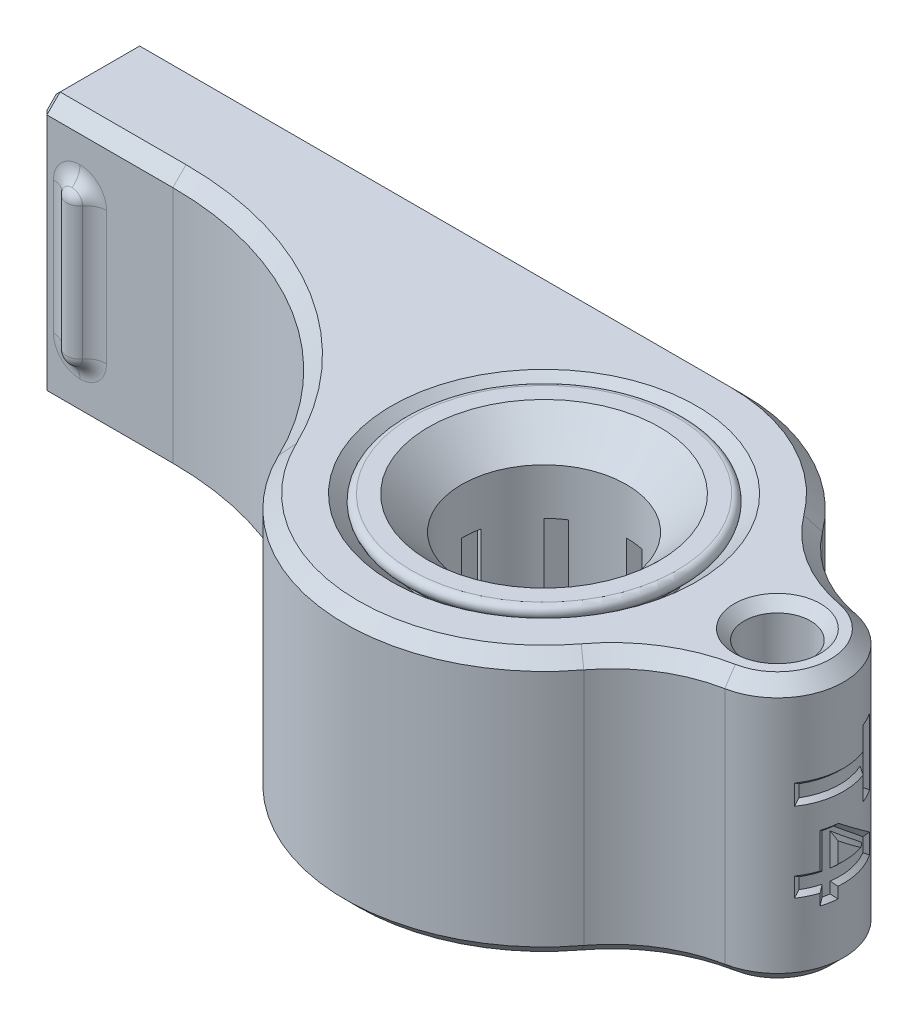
SolidWorks part; units mm, degrees
ref_plane "Ebene vorne" through (0, 0, 0) normal (0, 0, 1) x (1, 0, 0)
ref_plane "Ebene oben" through (0, 0, 0) normal (0, 1, 0) x (1, 0, 0)
ref_plane "Ebene rechts" through (0, 0, 0) normal (1, 0, 0) x (0, 0, -1)
sketch "Skizze2" plane through (0, 0, 0) normal (0, 1, 0) x (1, 0, 0)
  line L0 (0, 15) -> (-45, 15)
  line L1 (-45, 15) -> (-45, 7)
  line L2 (-45, 7) -> (-35, 7)
  arc A0 (-13.5167, -6.5038) -> (0, 15) centre (0, 0) ccw
  arc A1 (-35, 7) -> (-13.5167, -6.5038) centre (-35, -16.8409) cw
  dimension "D1" = 30
  dimension "D2" = 8
  dimension "D3" = 45
  dimension "D4" = 10
extrude "Aufsatz-Linear austragen1" add sketch "Skizze2" along normal blind 20
sketch "Skizze3" plane through (0, 20, 0) normal (0, 1, 0) x (1, 0, 0)
  circle A0 centre (0, 0) radius 8.5
  dimension "D1" = 17
extrude "Schnitt-Linear austragen1" cut sketch "Skizze3" against normal through all
ref_plane "Ebene1" through (0, 1.5, 0) normal (0, -1, 0) x (-1, 0, 0)
sketch "Skizze5" plane through (0, 1.5, 0) normal (0, -1, 0) x (-1, 0, 0)
  line L0 (45, 13.5) -> (0, 13.5)
  line L1 (35, 8.5) -> (45, 8.5)
  line L2 (45, 8.5) -> (45, 13.5)
  line L3 (45, 15) -> (45, 7) construction
  line L4 (0, 15) -> (45, 15) construction
  line L5 (45, 7) -> (35, 7) construction
  arc A0 (0, 13.5) -> (12.165, -5.8534) centre (0, 0) ccw
  arc A1 (12.165, -5.8534) -> (35, 8.5) centre (35, -16.8409) cw
  arc A2 (35, 7) -> (13.5167, -6.5038) centre (35, -16.8409) ccw construction
  circle A5 centre (0, 0) radius 10
  circle A6 centre (0, 0) radius 8.5 construction
  dimension "D3" = 1.5
  dimension "D1" = 1.5
  dimension "D2" = 1.5
extrude "Schnitt-Linear austragen2" cut sketch "Skizze5" against normal offset from surface (17 mm away) 1.5
chamfer "Fase3" distance 2 angle 45 2 edges at (0, 18.5, 10) (0, 1.5, -10)
chamfer "Fase1" distance 3 angle 45 2 edges at (0, 20, 8.5) (0, 0, 8.5)
ref_plane "Ebene2" through (0, 10, 0) normal (0, -1, 0) x (-1, 0, 0)
sketch "Skizze6" plane through (0, 10, 0) normal (0, -1, 0) x (-1, 0, 0)
  line L0 (0, 8.5) -> (2.0977, 11)
  line L1 (2.0977, 11) -> (3.5337, 11)
  line L2 (3.5337, 11) -> (0, 6.7887)
  line L3 (0, 6.7887) -> (0, 8.5)
  line L4 (0, 0) -> (0, 8.5) construction
  circle A0 centre (0, 0) radius 8.5 construction
  dimension "D1" = 40
  dimension "D2" = 1.1
  dimension "D3" = 11
extrude "Schnitt-Linear austragen3" cut sketch "Skizze6" against normal mid plane 8
pattern_circular "Kreismuster1" count 8 over 360 about axis through (0, 0, 0) along (0, 1, 0) of "Schnitt-Linear austragen3"
sketch "Skizze8" plane through (0, 0, 0) normal (1, 0, 0) x (0, 0, -1)
  line L0 (0, 0) -> (0, 25.1561) construction
  line L1 (11.2172, 20) -> (6.2172, 20)
  line L2 (6.2172, 20) -> (6.2172, 0)
  line L3 (6.2172, 0) -> (11.2172, 0)
  line L4 (11.2172, 0) -> (8.2172, 3)
  line L5 (-8.5, 3) -> (8.5, 3) construction
  line L6 (8.2172, 3) -> (8.2172, 17)
  line L7 (-8.5, 17) -> (8.5, 17) construction
  line L8 (8.2172, 17) -> (11.2172, 20)
  line L9 (8.5, 17) -> (11.5, 20) construction
  line L10 (11.5, 0) -> (8.5, 3) construction
  line L11 (8.5, 17) -> (11.5, 20) construction
  line L12 (15, 20) -> (-15, 20) construction
  line L13 (-15, 0) -> (15, 0) construction
  dimension "D1" = 0.2
  dimension "D2" = 2
revolve "Rotor" add sketch "Skizze8" angle 360 about L0
sketch "Skizze9" plane through (0, 10, 0) normal (0, -1, 0) x (-1, 0, 0)
  line L0 (0, 4.5059) -> (0, 6.2172)
  line L1 (0, 6.2172) -> (-1.5538, 8.0689)
  line L2 (0, 4.5059) -> (-2.7242, 7.7524)
  arc A0 (-1.5538, 8.0689) -> (-2.7242, 7.7524) centre (0, 0) ccw
  circle A1 centre (0, 0) radius 6.2172 construction
  circle A2 centre (0, 0) radius 8.2172 construction
  dimension "D1" = 40
  dimension "D2" = 1.1
extrude "Schnitt-Linear austragen4" cut sketch "Skizze9" against normal mid plane 8
pattern_circular "Kreismuster2" count 8 over 360 about axis through (0, 0, 0) along (0, 1, 0) of "Schnitt-Linear austragen4"
sketch "Skizze12" plane through (0, 10, 0) normal (0, 1, 0) x (1, 0, 0)
  line L1 (-45, 7) -> (-35, 7) construction
  line L2 (-45, 15) -> (-45, 7) construction
  line L3 (-43, 7) -> (-41, 7)
  arc A0 (-41, 7) -> (-43, 7) centre (-42, 7) cw
  dimension "D1" = 2
  dimension "D2" = 1
  dimension "D3" = 2
extrude "Aufsatz-Linear austragen3" add sketch "Skizze12" against normal mid plane 12
sketch "Skizze14" plane through (0, 0, 0) normal (0, 0, 1) x (1, 0, 0)
  line L0 (13.5, 14) -> (13.5, 6)
  line L1 (13.5, 1.5) -> (13.5, 18.5) construction
  line L2 (13.5, 6) -> (14.25, 6.8938)
  line L3 (14.25, 6.8938) -> (14.25, 13.1062)
  line L4 (14.25, 13.1062) -> (13.5, 14)
  line L5 (-15.4, 10) -> (15.4, 10) construction
  line L6 (0, 0) -> (0, 26.8942) construction
  point P9 (13.5, 10)
  point P10 (14.25, 10)
  dimension "D1" = 8
  dimension "D2" = 40
  dimension "D3" = 0.75
revolve "Schnitt-Rotation1" cut sketch "Skizze14" angle 360 about L6
fillet "Verrundung1" radius 0.5 2 edges at (0, 0, -11.2172) (0, 20, -11.2172)
chamfer "Fase2" distance 2.5 angle 45 2 edges at (0, 20, -6.2172) (0, 0, -6.2172)
chamfer "Fase4" distance 1 angle 45 8 edges at (-22.5, 18.5, -13.5) (-21.5143, 18.5, -4.6136) (-40, 18.5, -8.5) (-22.5, 1.5, -13.5) (-21.5143, 1.5, -4.6136) (-40, 1.5, -8.5) (11.4296, 18.5, 7.1843) (11.4296, 1.5, 7.1843)
sketch "Skizze11" plane through (0, 0, -8.5) normal (0, 0, -1) x (-1, 0, 0)
  line L0 (45, 17.5) -> (45, 2.5) construction
  line L1 (45, 10.75) -> (35, 10.75)
  line L2 (45, 10.75) -> (45, 9.25)
  line L3 (45, 9.25) -> (35, 9.25)
  line L4 (35, 10.75) -> (35, 9.25)
  line L6 (-15.4, 10) -> (15.4, 10) construction
  point P12 (45, 10)
  dimension "D1" = 1.5
  dimension "D2" = 10
extrude "Aufsatz-Linear austragen2" add sketch "Skizze11" along normal up to next
sketch "Skizze15" plane through (0, 10, 0) normal (0, -1, 0) x (-1, 0, 0)
  line L0 (41, 15) -> (43, 15)
  line L1 (43, 15) -> (42, 14.25)
  line L2 (42, 14.25) -> (41, 15)
  line L3 (42, 14.25) -> (42, 15) construction
  line L4 (45, 15) -> (45, 7) construction
  line L5 (0, 15) -> (45, 15) construction
  dimension "D1" = 2
  dimension "D2" = 0.75
  dimension "D3" = 2
extrude "Schnitt-Linear austragen5" cut sketch "Skizze15" against normal mid plane 10 contours L1 L2 L0
pattern_linear "Lineares Muster1" count 5 spacing 3 along (1, 0, 0) of "Schnitt-Linear austragen5"
sketch "Skizze17" plane through (0, 20, 0) normal (0, 1, 0) x (1, 0, 0)
  line L2 (17.6, 0) -> (0, 0) construction
  arc A0 (-13.5167, -6.5038) -> (0, 15) centre (0, 0) ccw construction
  arc A1 (12, -9) -> (12, 9) centre (0, 0) ccw
  arc A2 (18.5438, 4.9101) -> (18.5438, -4.9101) centre (17.6, 0) cw
  circle A3 centre (17.6, 0) radius 2.5
  arc A4 (12, 9) -> (18.5438, 4.9101) centre (20.5647, 15.4235) ccw
  arc A5 (18.5438, -4.9101) -> (12, -9) centre (20.5647, -15.4235) ccw
  dimension "D1" = 5
  dimension "D2" = 2.5
  dimension "D3" = 0.1
  dimension "D4" = 18
extrude "Aufsatz-Linear austragen5" add sketch "Skizze17" against normal up to surface (20 mm away) contours A2 A5 A1 A4 | A3
ref_plane "Ebene3" through (22.6, 0, 0) normal (1, 0, 0) x (0, 0, -1)
sketch "Skizze16" plane through (22.6, 0, 18.9001) normal (-1, 0, 0) x (0, 0, 1)
  line L0 (-15.9001, 0) -> (-15.9001, 20) construction
  line L1 (-3.9001, 20) -> (-12.3963, 20) construction
  line L2 (-12.3963, 0) -> (-3.9001, 0) construction
  text T0 "T4" font "Tahoma" height 6
  dimension "D1" = 3
wrap "Umwickeln1" sketch "Skizze16" wrap type deboss source sketch "Skizze16" thickness 0.3 parameters "D1"=0.3
fillet "Fase10" radius 0.3 22 edges at (22.074, 5.443, 1.44) (21.8204, 5.8608, 2.0684) (21.4791, 6.5823, 2.6538) (21.8204, 7.3038, 2.0684) (22.1442, 5.8608, -1.2002) (22.2836, 5.443, 0.3922) (22.2695, 13.3797, 0.5343) (21.9783, 14.2532, -1.709) (21.7556, 15.1266, -2.1957) (21.4791, 12.6203, -2.6538) (21.7556, 10.1139, -2.1957) (22.2695, 11.8608, 0.5343) (22.074, 8.6329, 1.44) (22.2087, 5.0253, 0.9221) (21.9783, 10.9873, -1.709) (21.4791, 12.6203, 2.6538)
chamfer "Fase5" distance 1 angle 45 16 edges at (-22.5, 0, -15) (-1.4604, 0, 14.9287) (6.7082, 0, -13.4164) (-22.3125, 0, -3.3437) (-40, 0, -7) (-22.5, 20, -15) (-1.4604, 20, 14.9287) (6.7082, 20, -13.4164) (-22.3125, 20, -3.3437) (-40, 20, -7) (14.8906, 0, -6.345) (14.8906, 20, -6.345) (22.6, 0, 0) (22.6, 20, 0) (14.8906, 0, 6.345) (14.8906, 20, 6.345)
chamfer "Fase9" distance 0.75 angle 45 10 edges at (-42, 5, -15) (-39, 5, -15) (-36, 5, -15) (-33, 5, -15) (-30, 5, -15) (-30, 15, -15) (-33, 15, -15) (-36, 15, -15) (-39, 15, -15) (-42, 15, -15)
chamfer "Fase6" distance 1 angle 45 6 edges at (-40, 10.75, -8.5) (-40, 10.75, -13.5) (-40, 9.25, -13.5) (-40, 9.25, -8.5) (-35, 10, -13.5) (-35, 10, -8.5)
fillet "Verrundung2" radius 1.5 2 edges at (0, 3, 8.5) (0, 16.5, 10)
chamfer "Fase7" distance 0.5 angle 45 24 edges at (-45, 19.5, -7.5) (-45, 10, -7) (-45, 0.5, -7.5) (-45, 0, -11) (-45, 0.5, -14.5) (-45, 10, -15) (-45, 19.5, -14.5) (-45, 20, -11) (-45, 18.5, -11) (-45, 18, -13) (-45, 14.625, -13.5) (-45, 11.25, -13) (-45, 10.75, -11) (-45, 11.25, -9) (-45, 14.625, -8.5) (-45, 18, -9) (-45, 2, -9) (-45, 1.5, -11) (-45, 2, -13) (-45, 5.375, -13.5) (-45, 8.75, -13) (-45, 9.25, -11) (-45, 8.75, -9) (-45, 5.375, -8.5)
fillet "Verrundung5" radius 1 2 edges at (-42, 16, -6) (-42, 4, -6)
fillet "Verrundung6" radius 1.5 6 edges at (-41.2929, 4.2929, -7) (-42.7071, 4.2929, -7) (-41, 10, -7) (-43, 10, -7) (-42.7071, 15.7071, -7) (-41.2929, 15.7071, -7)
chamfer "Fase11" distance 0.75 angle 45 2 edges at (17.6, 0, 2.5) (17.6, 20, 2.5)
fillet "Verrundung9" radius 0.6 10 edges at (-4.5621, 10, -13.5) (11.4296, 6, 7.1843) (11.4296, 14, 7.1843) (12.3047, 13.1062, 7.1872) (12.3047, 6.8938, 7.1872) (-13.9999, 10, 2.6578) (-12.6306, 6.0717, 4.9342) (-13.4805, 13.5028, 3.4592)
